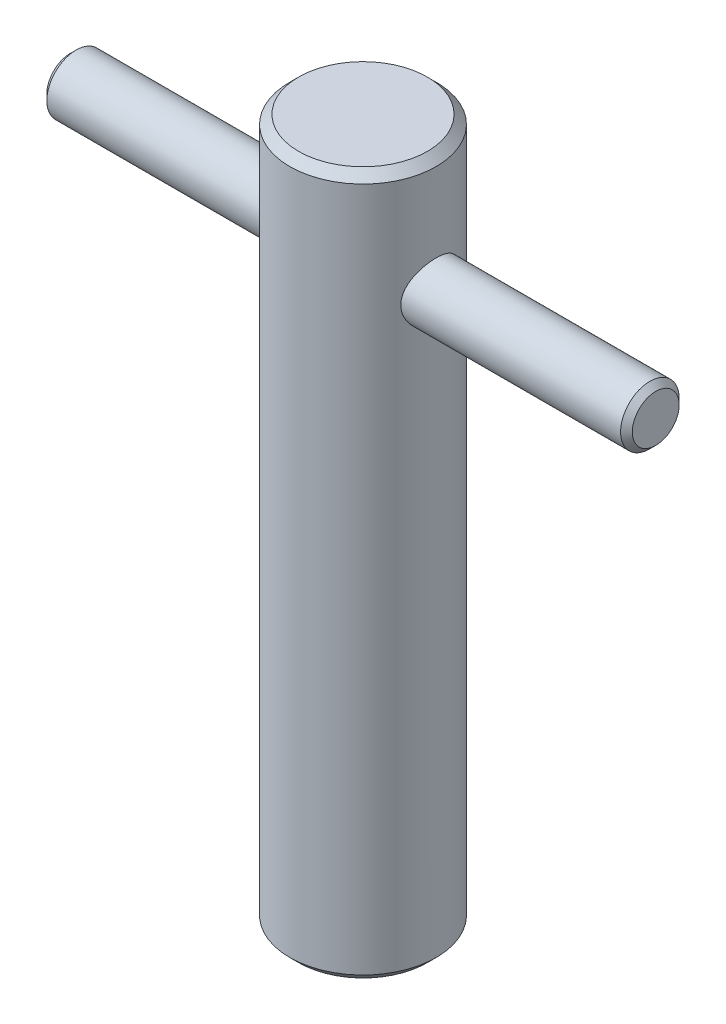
SolidWorks part; units mm, degrees
ref_plane "Спереди" through (0, 0, 0) normal (0, 0, 1) x (1, 0, 0)
ref_plane "Сверху" through (0, 0, 0) normal (0, 1, 0) x (1, 0, 0)
ref_plane "Справа" through (0, 0, 0) normal (1, 0, 0) x (0, 0, -1)
sketch "Эскиз1" plane through (0, 0, 0) normal (0, 1, 0) x (1, 0, 0)
  circle A0 centre (0, 0) radius 12.5
  dimension "D1" = 25
extrude "Бобышка-Вытянуть1" add sketch "Эскиз1" along normal blind 120
chamfer "Фаска1" distance 1.5 angle 45 2 edges at (0, 0, 12.5) (0, 120, 12.5)
sketch "Эскиз2" plane through (0, 0, 0) normal (0, -1, 0) x (1, 0, 0)
  line L1 (5, 5) -> (-5, 5)
  line L2 (5, 5) -> (5, -5)
  line L3 (5, -5) -> (-5, -5)
  line L4 (-5, 5) -> (-5, -5)
  line L5 (5, 5) -> (-5, -5) construction
  line L6 (5, -5) -> (-5, 5) construction
  point P0 (0, 0)
  dimension "D1" = 10
extrude "Вырез-Вытянуть1" cut sketch "Эскиз2" against normal blind 30
sketch "Эскиз3" plane through (0, 0, 0) normal (1, 0, 0) x (0, 0, -1)
  line L0 (11, 120) -> (-11, 120) construction
  circle A0 centre (0, 100) radius 5
  dimension "D1" = 10
  dimension "D2" = 20
extrude "Вырез-Вытянуть2" cut sketch "Эскиз3" against normal mid plane 30
sketch "Эскиз4" plane through (0, 0, 0) normal (1, 0, 0) x (0, 0, -1)
  circle A0 centre (0, 100) radius 5 construction
  circle A1 centre (0, 100) radius 5
extrude "Бобышка-Вытянуть2" add sketch "Эскиз4" along normal mid plane 100 separate body
chamfer "Фаска2" distance 1 angle 45 2 edges at (-50, 100, -5) (50, 100, -5)
